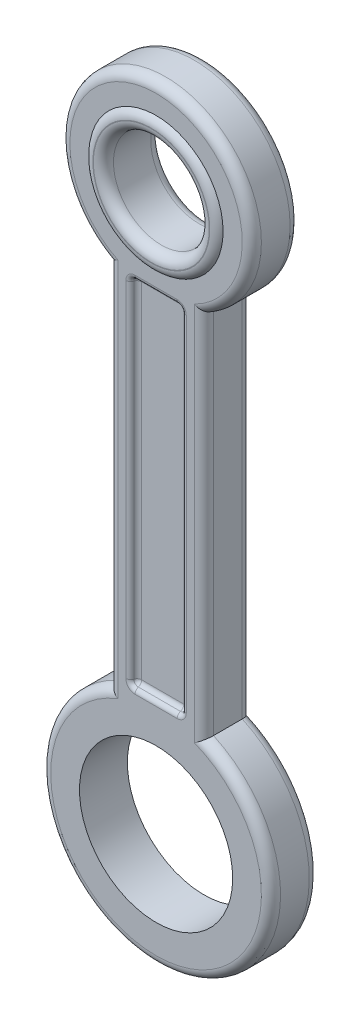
SolidWorks part; units mm, degrees
ref_plane "Plan de face" through (0, 0, 0) normal (0, 0, 1) x (1, 0, 0)
ref_plane "Plan de dessus" through (0, 0, 0) normal (0, 1, 0) x (1, 0, 0)
ref_plane "Plan de droite" through (0, 0, 0) normal (1, 0, 0) x (0, 0, -1)
sketch "Esquisse1" plane through (0, 0, 0) normal (0, 0, 1) x (1, 0, 0)
  line L0 (-5, -8.6603) -> (-5, -47.0913)
  line L1 (5, -8.6603) -> (5, -47.0913)
  line L2 (0, 53.6411) -> (0, -123.5185) construction
  arc A0 (5, -8.6603) -> (-5, -8.6603) centre (0, 0) ccw
  arc A1 (-5, -47.0913) -> (5, -47.0913) centre (0, -58) ccw
  point P11 (0, 10)
  point P12 (0, -70)
  dimension "D1" = 20
  dimension "D2" = 24
  dimension "D3" = 80
  dimension "D4" = 10
extrude "Boss.-Extru.1" add sketch "Esquisse1" along normal mid plane 5
sketch "Esquisse2" plane through (0, 0, 0) normal (0, 0, 1) x (1, 0, 0)
  circle A0 centre (0, 0) radius 5
  circle A1 centre (0, -58) radius 8
  dimension "D1" = 10
  dimension "D2" = 16
extrude "Enlèv. mat.-Extru.2" cut sketch "Esquisse2" against normal up to next and the other way up to next
sketch "Esquisse4" plane through (0, 0, -2.5) normal (0, 0, -1) x (-1, 0, 0)
  circle A0 centre (0, 0) radius 7
  circle A1 centre (0, 0) radius 5
  dimension "D1" = 14
  dimension "D2" = 10
extrude "Boss.-Extru.2" add sketch "Esquisse4" along normal blind 0.5
sketch "Esquisse5" plane through (0, 0, -2.5) normal (0, 0, -1) x (-1, 0, 0)
  line L0 (0, 15.7954) -> (0, -72.3333) construction
  line L1 (-2.7, -9) -> (2.7, -9)
  line L2 (-2.7, -9) -> (-2.7, -46)
  line L3 (-2.7, -46) -> (2.7, -46)
  line L4 (2.7, -9) -> (2.7, -46)
  point P7 (0, -9)
  dimension "D1" = 37
  dimension "D2" = 5.4
  dimension "D3" = 9
extrude "Enlèv. mat.-Extru.3" cut sketch "Esquisse5" against normal blind 0.7
mirror "Symétrie3" about plane through (0, 0, 0) normal (0, 0, 1) of "Enlèv. mat.-Extru.3", "Boss.-Extru.2"
fillet "Congé2" radius 1.05 4 edges at (-5, 0, -3) (-7, 0, -3) (-7, 0, 3) (-5, 0, 3)
fillet "Congé3" radius 1 4 edges at (5, -27.8758, 2.5) (-5, -27.8758, 2.5) (-5, -27.8758, -2.5) (5, -27.8758, -2.5)
fillet "Congé4" radius 0.5 4 edges at (2.7, -27.5, 1.8) (-2.7, -27.5, 1.8) (-2.7, -27.5, -1.8) (2.7, -27.5, -1.8)
fillet "Congé5" radius 0.5 20 edges at (0, -9, -1.8) (0, -46, -1.8) (0, -46, 1.8) (0, -9, 1.8) (2.7, -46, 2.4) (2.5536, -46, 1.9464) (-2.7, -46, 2.4) (-2.5536, -46, 1.9464) (-2.7, -9, 2.4) (-2.5536, -9, 1.9464) (2.7, -9, 2.4) (2.5536, -9, 1.9464) (-2.7, -9, -2.4) (-2.5536, -9, -1.9464) (2.7, -9, -2.4) (2.5536, -9, -1.9464) (2.7, -46, -2.4) (2.5536, -46, -1.9464) (-2.7, -46, -2.4) (-2.5536, -46, -1.9464)
fillet "Congé6" radius 0.5 16 edges at (2.5536, -9.1464, -2.5) (0, -9, -2.5) (-2.5536, -9.1464, -2.5) (-2.5536, -45.8536, -2.5) (0, -46, -2.5) (2.5536, -45.8536, -2.5) (-2.5536, -45.8536, 2.5) (0, -46, 2.5) (2.5536, -45.8536, 2.5) (2.5536, -9.1464, 2.5) (0, -9, 2.5) (-2.5536, -9.1464, 2.5) (-2.7, -27.5, -2.5) (2.7, -27.5, -2.5) (2.7, -27.5, 2.5) (-2.7, -27.5, 2.5)
fillet "Congé7" radius 1 4 edges at (0, -70, 2.5) (0, -70, -2.5) (0, 10, 2.5) (0, 10, -2.5)
